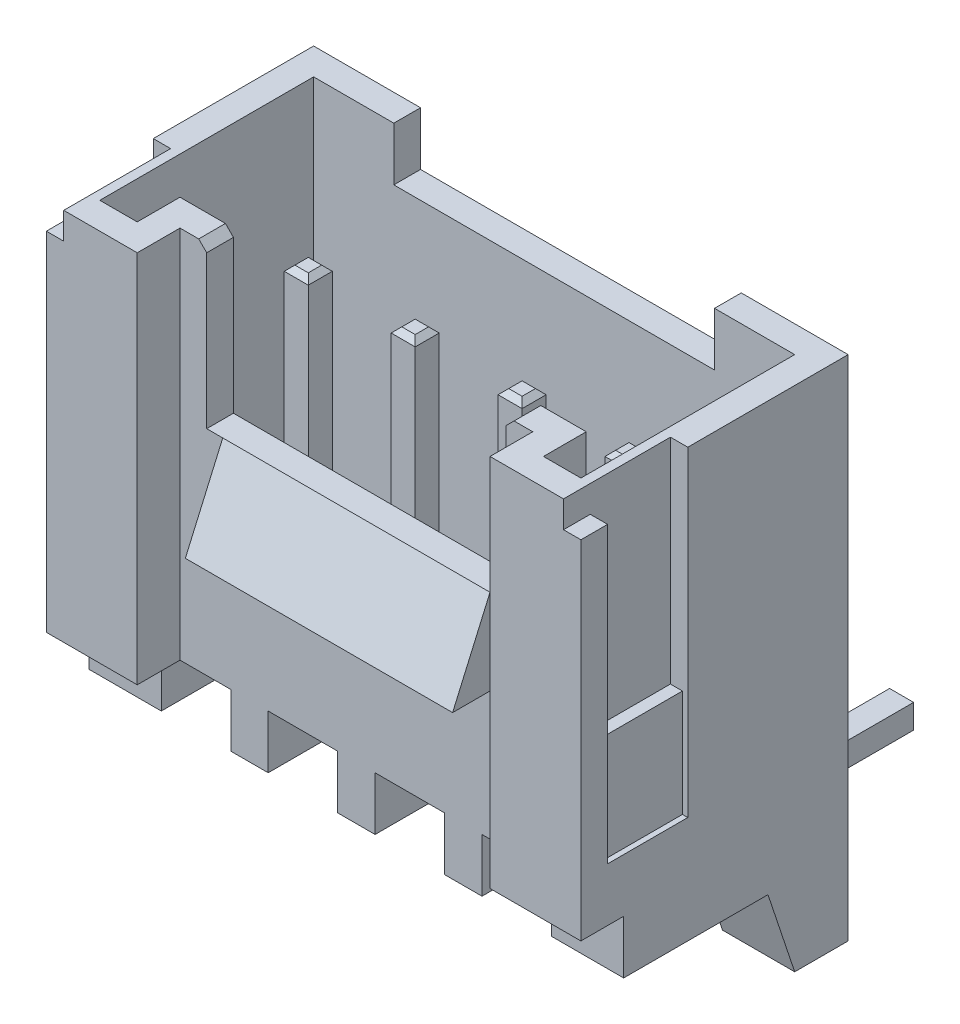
SolidWorks part; units mm, degrees
ref_plane "Plan de face" through (0, 0, 0) normal (0, 0, 1) x (1, 0, 0)
ref_plane "Plan de dessus" through (0, 0, 0) normal (0, 1, 0) x (1, 0, 0)
ref_plane "Plan de droite" through (0, 0, 0) normal (1, 0, 0) x (0, 0, -1)
sketch "Esquisse1" plane through (0, 0, 0) normal (0, 1, 0) x (1, 0, 0)
  line L1 (-5, 0) -> (5, 0)
  line L2 (-5, 0) -> (-5, 5)
  line L3 (-5, 5) -> (5, 5)
  line L4 (5, 0) -> (5, 5)
  dimension "D1" = 10
  dimension "D2" = 5
extrude "Boss.-Extru.1" add sketch "Esquisse1" along normal blind 8
sketch "Esquisse7" plane through (5, 0, 0) normal (1, 0, 0) x (0, 0, -1)
  line L1 (0, 0) -> (0.8, 0)
  line L2 (0, 0) -> (0, 1)
  line L3 (0, 1) -> (0.8, 1)
  line L4 (0.8, 0) -> (0.8, 1)
  dimension "D1" = 0.8
  dimension "D2" = 1
extrude "Enlèv. mat.-Extru.5" cut sketch "Esquisse7" against normal through all
ref_plane "Plan1" through (3, 0, 0) normal (1, 0, 0) x (0, 0, -1)
sketch "Esquisse8" plane through (3, 0, 0) normal (1, 0, 0) x (0, 0, -1)
  line L0 (0.8, 1) -> (1.1, 1)
  line L1 (1.1, 1) -> (1.9, 0.2)
  line L2 (1.9, 0.2) -> (3.9, 0.2)
  line L3 (3.9, 0.2) -> (4.7, 1)
  line L4 (4.7, 1) -> (5, 1)
  line L5 (5, 8) -> (5, 0) construction
  line L6 (5, 1) -> (5, 0)
  line L7 (5, 0) -> (0.8, 0)
  line L8 (0.8, 0) -> (0.8, 1)
  line L9 (0.8, 0) -> (0.8, 1) construction
  dimension "D1" = 0.2
  dimension "D2" = 0.3
  dimension "D3" = 45
extrude "Enlèv. mat.-Extru.6" cut sketch "Esquisse8" against normal mid plane 1.3
pattern_linear "Répétition linéaire3" count 4 spacing 2 along (-1, 0, 0) of "Enlèv. mat.-Extru.6"
sketch "Esquisse2" plane through (0, 8, 0) normal (0, 1, 0) x (1, 0, 0)
  line L0 (-5, 0) -> (5, 0) construction
  line L1 (-3.3, -0.8) -> (3.3, -0.8)
  line L2 (-3.3, -0.8) -> (-3.3, 0.8)
  line L3 (-3.3, 0.8) -> (3.3, 0.8)
  line L4 (3.3, -0.8) -> (3.3, 0.8)
  line L5 (-3.3, -0.8) -> (3.3, 0.8) construction
  line L6 (-3.3, 0.8) -> (3.3, -0.8) construction
  line L7 (5, 0) -> (5, 5) construction
  point P0 (0, 0)
  dimension "D1" = 0.8
  dimension "D2" = 1.7
extrude "Enlèv. mat.-Extru.1" cut sketch "Esquisse2" against normal through all
sketch "Esquisse4" plane through (0, 8, 0) normal (0, 1, 0) x (1, 0, 0)
  line L16 (-3.8, 1.3) -> (3.8, 1.3)
  line L17 (3.8, 1.3) -> (3.8, 0.5)
  line L18 (3.8, 0.5) -> (4.5, 0.5)
  line L19 (4.5, 0.5) -> (4.5, 4.5)
  line L20 (4.5, 4.5) -> (-4.5, 4.5)
  line L21 (-4.5, 4.5) -> (-4.5, 0.5)
  line L22 (-4.5, 0.5) -> (-3.8, 0.5)
  line L23 (-3.8, 0.5) -> (-3.8, 1.3)
  line L24 (-3.8, 1.3) -> (3.8, 1.3)
  line L25 (3.8, 1.3) -> (3.8, 0.5)
  line L26 (3.8, 0.5) -> (4.5, 0.5)
  line L27 (4.5, 0.5) -> (4.5, 4.5)
  line L28 (4.5, 4.5) -> (-4.5, 4.5)
  line L29 (-4.5, 4.5) -> (-4.5, 0.5)
  line L30 (-4.5, 0.5) -> (-3.8, 0.5)
  line L31 (-3.8, 0.5) -> (-3.8, 1.3)
  dimension "D1" = 0.5
extrude "Enlèv. mat.-Extru.2" cut sketch "Esquisse4" against normal blind 6.5
sketch "Esquisse5" plane through (0, 8, 0) normal (0, 1, 0) x (1, 0, 0)
  line L0 (4.5, 4.5) -> (-4.5, 4.5) construction
  line L1 (-3, 4) -> (3, 4)
  line L2 (-3, 4) -> (-3, 5)
  line L3 (-3, 5) -> (3, 5)
  line L4 (3, 4) -> (3, 5)
  line L5 (-3, 4) -> (3, 5) construction
  line L6 (-3, 5) -> (3, 4) construction
  line L7 (5, 5) -> (-5, 5) construction
  line L8 (5, 0) -> (5, 5) construction
  point P0 (0, 4.5)
  dimension "D1" = 2
extrude "Enlèv. mat.-Extru.3" cut sketch "Esquisse5" against normal blind 1
sketch "Esquisse6" plane through (0, 8, 0) normal (0, 1, 0) x (1, 0, 0)
  line L0 (3.3, 0.8) -> (-3.3, 0.8) construction
  line L1 (-2.8, 0.3) -> (2.8, 0.3)
  line L2 (-2.8, 0.3) -> (-2.8, 1.3)
  line L3 (-2.8, 1.3) -> (2.8, 1.3)
  line L4 (2.8, 0.3) -> (2.8, 1.3)
  line L5 (-2.8, 0.3) -> (2.8, 1.3) construction
  line L6 (-2.8, 1.3) -> (2.8, 0.3) construction
  line L7 (-3.8, 1.3) -> (3.8, 1.3) construction
  line L8 (5, 0) -> (5, 5) construction
  point P0 (0, 0.8)
  dimension "D1" = 2.2
extrude "Enlèv. mat.-Extru.4" cut sketch "Esquisse6" against normal blind 3
sketch "Esquisse11" plane through (0, 0, 0) normal (1, 0, 0) x (0, 0, -1)
  line L0 (0.8, 5) -> (0.1, 3.4)
  line L1 (0.8, 5) -> (0.8, 8) construction
  line L2 (1.3, 5) -> (0.8, 5) construction
  line L3 (0.1, 3.4) -> (0.8, 3.4)
  line L4 (0.8, 1) -> (0.8, 8) construction
  line L5 (0.8, 3.4) -> (0.8, 5)
  dimension "D1" = 0.7
  dimension "D2" = 1.6
extrude "Boss.-Extru.2" add sketch "Esquisse11" along normal mid plane 5
chamfer "Chanfrein1" distance 0.15 angle 45 2 edges at (2.8, 8, -1.05) (-2.8, 8, -1.05)
sketch "Esquisse16" plane through (3, 0, 0) normal (-1, 0, 0) x (0, 0, 1)
  line L0 (-2.9, 6.5) -> (-2.9, -0.0271)
  line L2 (-3.9, 0.2) -> (-1.9, 0.2) construction
  line L3 (-5, 8) -> (-5, 0) construction
  line L5 (-3.076, -0.2467) -> (-8, -0.2467)
  line L7 (-5, 0) -> (-0.8, 0) construction
  arc A1 (-2.9, -0.0271) -> (-3.076, -0.2467) centre (-3.125, -0.0271) cw
  point P2 (-2.9, 0.2)
  point P3 (-5.1392, -0.2467)
  point P7 (-4.775, -0.1706)
  point P13 (-4.775, -0.7)
  point P16 (-2.9, -0.2)
  dimension "D4" = 0.5
  dimension "D1" = 0.4
  dimension "D2" = 6.3
  dimension "D3" = 3
  dimension "D5" = 0.2467
extrude "Extru.-Mince2" add sketch "Esquisse16" along normal mid plane 0.45 separate body thin
ref_plane "Plan2" through (0, -1.6, 0) normal (0, -1, 0) x (-1, 0, 0)
pattern_linear "Répétition linéaire4" count 4 spacing 2 along (-1, 0, 0)
sketch "Esquisse18" plane through (-5, 0, 0) normal (-1, 0, 0) x (0, 0, 1)
  line L0 (-5, 0) -> (-5, -1.5)
  line L1 (-5, -1.5) -> (-4, -1.5)
  line L2 (-4, -1.5) -> (-3.5, 0)
  line L3 (-5, 0) -> (-0.8, 0) construction
  line L4 (-3.5, 0) -> (-5, 0)
  dimension "D1" = 1.5
  dimension "D2" = 1.5
  dimension "D3" = 1
extrude "Boss.-Extru.4" add sketch "Esquisse18" against normal blind 1.35
chamfer "Chanfrein2" distance 0.1 angle 45 4 edges at (3, 6.5, -2.675) (2.775, 6.5, -2.9) (3, 6.5, -3.125) (3.225, 6.5, -2.9)
sketch "Esquisse19" plane through (-5, 0, 0) normal (-1, 0, 0) x (0, 0, 1)
  line L0 (-3.5, 0) -> (-0.8, 0) construction
  line L1 (-2, 8.4401) -> (-0.5, 8.4401)
  line L2 (-2, 8.4401) -> (-2, 2)
  line L3 (-2, 2) -> (-0.5, 2)
  line L4 (-0.5, 8.4401) -> (-0.5, 2)
  line L5 (0, 8) -> (0, 1) construction
  dimension "D1" = 2
  dimension "D2" = 0.5
  dimension "D3" = 1.5
extrude "Enlèv. mat.-Extru.7" cut sketch "Esquisse19" against normal blind 0.1
sketch "Esquisse20" plane through (-4.9, 0, 0) normal (-1, 0, 0) x (0, 0, 1)
  line L0 (-2, 8) -> (-2, 2) construction
  line L1 (-2, 4) -> (-0.5, 4)
  line L2 (-2, 4) -> (-2, 8.3888)
  line L3 (-2, 8.3888) -> (0.5607, 8.3888)
  line L4 (-0.5, 4) -> (-0.5, 7.5)
  line L5 (-0.5, 2) -> (-0.5, 8) construction
  line L6 (-2, 2) -> (-0.5, 2) construction
  line L7 (-0.5, 7.5) -> (0.5607, 7.5)
  line L8 (0.5607, 7.5) -> (0.5607, 8.3888)
  line L9 (-0.5, 8) -> (0, 8) construction
  dimension "D1" = 2
  dimension "D2" = 0.5
extrude "Enlèv. mat.-Extru.8" cut sketch "Esquisse20" against normal blind 0.225 and the other way blind 0.225
mirror "Symétrie5" about plane through (0, 0, 0) normal (1, 0, 0) of "Enlèv. mat.-Extru.7"
mirror "Symétrie6" about plane through (0, 0, 0) normal (1, 0, 0) of "Enlèv. mat.-Extru.8"
chamfer "Chanfrein3" distance 0.1 angle 45 4 edges at (-3, 6.5, -2.675) (-3.225, 6.5, -2.9) (-3, 6.5, -3.125) (-2.775, 6.5, -2.9)
chamfer "Chanfrein4" distance 0.1 angle 45 4 edges at (-1, 6.5, -2.675) (-1.225, 6.5, -2.9) (-1, 6.5, -3.125) (-0.775, 6.5, -2.9)
chamfer "Chanfrein5" distance 0.1 angle 45 4 edges at (1, 6.5, -2.675) (0.775, 6.5, -2.9) (1, 6.5, -3.125) (1.225, 6.5, -2.9)
mirror "Symétrie8" about plane through (0, 0, 0) normal (1, 0, 0) of "Boss.-Extru.4"
